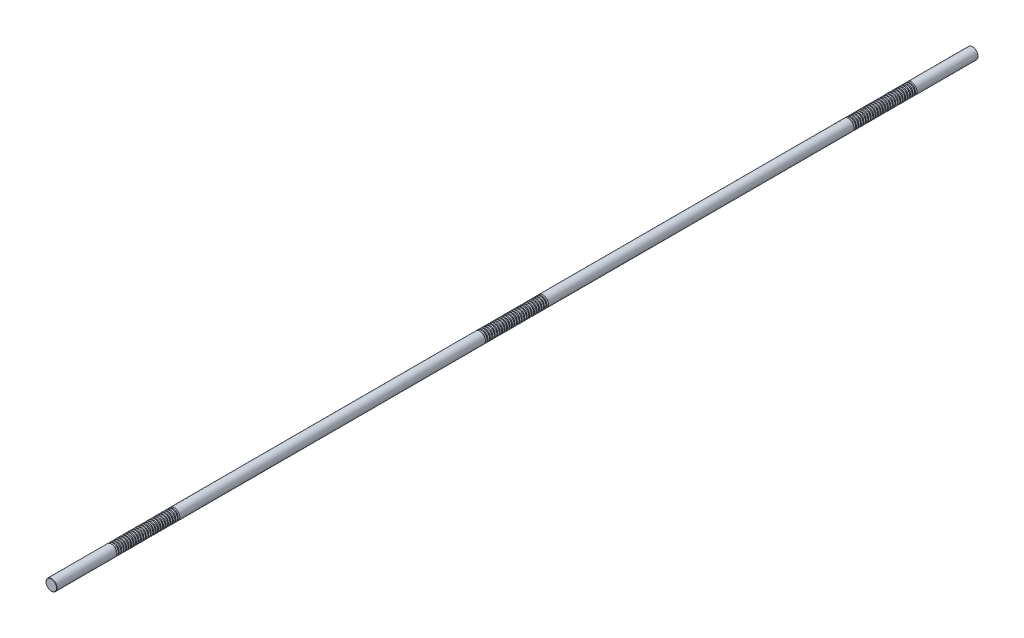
SolidWorks part; units mm, degrees
ref_plane "Front Plane" through (0, 0, 0) normal (0, 0, 1) x (1, 0, 0)
ref_plane "Top Plane" through (0, 0, 0) normal (0, 1, 0) x (1, 0, 0)
ref_plane "Right Plane" through (0, 0, 0) normal (1, 0, 0) x (0, 0, -1)
sketch "Sketch1" plane through (0, 0, 0) normal (0, 0, 1) x (1, 0, 0)
  circle A0 centre (0, 0) radius 9
  dimension "D1" = 18
extrude "Boss-Extrude1" add sketch "Sketch1" along normal mid plane 1500
chamfer "Chamfer1" distance 0.45 angle 45 2 edges at (9, 0, -750) (9, 0, 750)
sketch "Sketch2" plane through (0, 0, 0) normal (1, 0, 0) x (0, 0, -1)
  line L0 (650.3014, 9) -> (647.6986, 9)
  line L1 (749.55, 9) -> (-749.55, 9) construction
  line L2 (647.6986, 9) -> (648.3014, 6.75)
  line L3 (648.3014, 6.75) -> (649.6986, 6.75)
  line L4 (649.6986, 6.75) -> (650.3014, 9)
  line L5 (750, -8.55) -> (750, 8.55) construction
  point P4 (649, 9)
  point P7 (649, 6.75)
  point P8 (650, 7.875)
  point P9 (648, 7.875)
  dimension "D1" = 2
  dimension "D2" = 100
  dimension "D3" = 2.25
  dimension "D4" = 30
revolve "Cut-Revolve1" cut sketch "Sketch2" angle 360 about axis through (0, 0, 750) along (0, 0, -1)
pattern_linear "LPattern1" count 26 spacing 4 along (0, 0, 1) of "Cut-Revolve1"
pattern_linear "LPattern2" count 3 spacing 600 along (0, 0, 1) of "Cut-Revolve1", "LPattern1"
